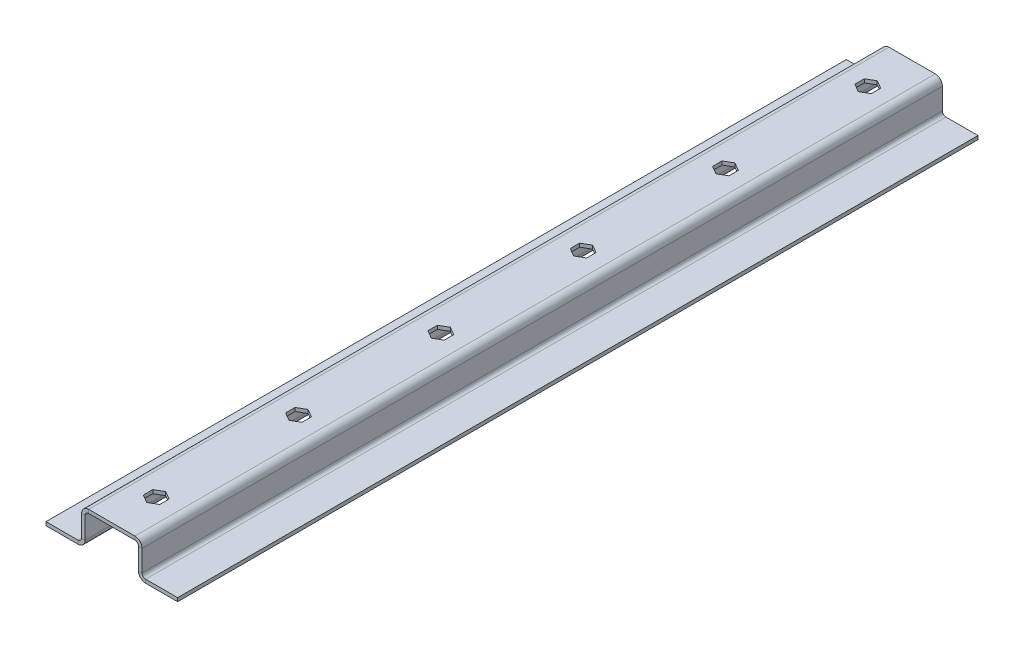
SolidWorks part; units mm, degrees
other "N" parameters "Epaisseur"=2
ref_plane "Plan de face" through (0, 0, 0) normal (0, 0, 1) x (1, 0, 0)
ref_plane "Plan de dessus" through (0, 0, 0) normal (0, 1, 0) x (1, 0, 0)
ref_plane "Plan de droite" through (0, 0, 0) normal (1, 0, 0) x (0, 0, -1)
imported_body "Importée1"
sheet metal parameters "Tôlerie 1" parameters "D1"=0.1
bend "Pli issu d'un arrondi1" bend radius 2 bend angle 90 parameters "D5"=1
flatten bends "Dépliage 1"
sketch "Esquisse-Angle1" plane through (0, -9, 0) normal (0, 1, 0) x (-1, 0, 0)
  line L0 (15.35, 509.965) -> (15.35, 59.965) construction
  line L1 (-15.35, 59.965) -> (-15.35, 509.965) construction
  line L2 (-32.05, 509.965) -> (-32.05, 59.965) construction
  line L3 (32.05, 59.965) -> (32.05, 509.965) construction
bend "Pli issu d'un arrondi2" bend radius 2 bend angle 90 parameters "D5"=2
bend "Pli issu d'un arrondi3" bend radius 2 bend angle 90 parameters "D5"=3
bend "Pli issu d'un arrondi4" bend radius 2 bend angle 90 parameters "D5"=4
process bends "Pliage 1" parameters "D1"=0
sketch "Esquisse-Plate1" plane through (0, -9, 0) normal (0, 1, 0) x (-1, 0, 0)
sketch "Esquisse5" plane through (0, -9, 0) normal (0, 1, 0) x (1, 0, 0)
  line L0 (-19, -509.965) -> (-19, -59.965) construction
  line L1 (0, -90.2516) -> (4.6, -87.5958)
  line L2 (4.6, -87.5958) -> (4.6, -82.2842)
  line L3 (4.6, -82.2842) -> (0, -79.6284)
  line L4 (0, -79.6284) -> (-4.6, -82.2842)
  line L5 (-4.6, -82.2842) -> (-4.6, -87.5958)
  line L6 (-4.6, -87.5958) -> (0, -90.2516)
  circle A0 centre (0, -84.94) radius 4.6 construction
  dimension "D1" = 9.2
extrude "Enlèv. mat.-Extru.1" cut sketch "Esquisse5" against normal up to next
pattern_linear "Répétition linéaire1" count 6 spacing 80.01 along (0, 0, 1) of "Enlèv. mat.-Extru.1"
ref_plane "Plan1" through (0, 0, 284.965) normal (0, 0, 1) x (1, 0, 0)
flat pattern "Etat déplié1"
sketch "Lignes de pliage1" plane through (0, -9, 0) normal (0, 1, 0) x (-1, 0, 0)
  line L0 (32.05, 509.965) -> (32.05, 59.965) construction
  line L1 (-32.05, 59.965) -> (-32.05, 509.965) construction
  line L2 (-15.35, 59.965) -> (-15.35, 509.965) construction
  line L3 (15.35, 509.965) -> (15.35, 59.965) construction
  line L4 (32.05, 509.965) -> (32.05, 59.965) construction
  line L5 (-32.05, 59.965) -> (-32.05, 509.965) construction
  line L6 (-15.35, 59.965) -> (-15.35, 509.965) construction
  line L7 (15.35, 509.965) -> (15.35, 59.965) construction
sketch3d "Cube de visualisation1" [suppressed]
  line L0 (92.8226, -75.035, 0) -> (92.8226, -525.035, 0) construction
  line L1 (-11.9773, -75.035, 0) -> (-11.9773, -525.035, 0) construction
  line L2 (92.8226, -75.035, 0) -> (-11.9773, -75.035, 0) construction
  line L3 (92.8226, -525.035, 0) -> (-11.9773, -525.035, 0) construction
bend of the flat pattern "Dépliage-<Pli issu d'un arrondi1>1"
bend of the flat pattern "Dépliage-<Pli issu d'un arrondi2>1"
bend of the flat pattern "Dépliage-<Pli issu d'un arrondi3>1"
bend of the flat pattern "Dépliage-<Pli issu d'un arrondi4>1"
